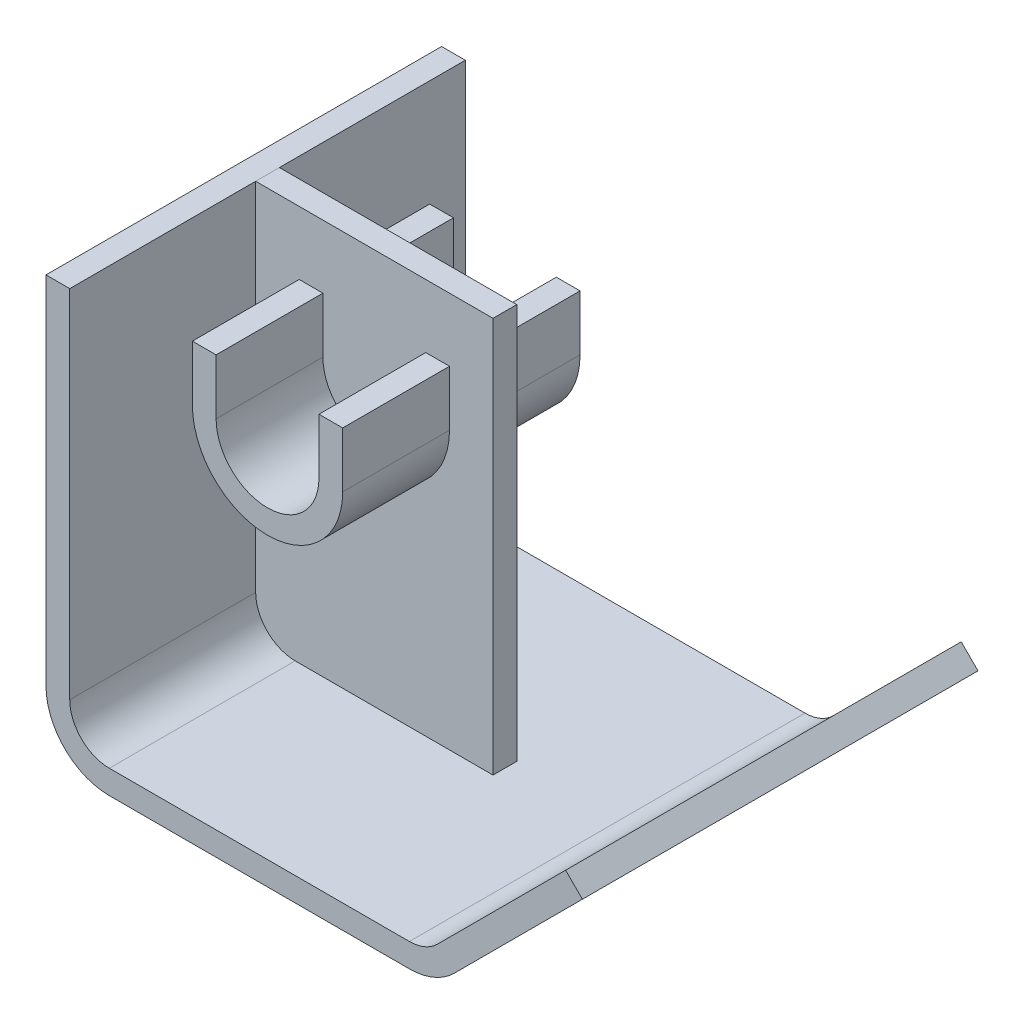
SolidWorks part; units mm, degrees
ref_plane "Front Plane" through (0, 0, 0) normal (0, 0, 1) x (1, 0, 0)
ref_plane "Top Plane" through (0, 0, 0) normal (0, 1, 0) x (1, 0, 0)
ref_plane "Right Plane" through (0, 0, 0) normal (1, 0, 0) x (0, 0, -1)
sketch "Sketch1" plane through (0, 0, 0) normal (0, 0, 1) x (1, 0, 0)
  line L0 (0, 0) -> (0, 50)
  line L1 (0, 0) -> (45, 0)
  line L2 (45, 0) -> (62.6777, 17.6777)
  dimension "D1" = 25
  dimension "D4" = 135
  dimension "D2" = 50
  dimension "D3" = 45
extrude "Extrude-Thin1" add sketch "Sketch1" along normal mid plane 50 thin
sketch "Sketch2" plane through (0, 0, 0) normal (1, 0, 0) x (0, 0, -1)
  line L0 (0, 50) -> (0, 0)
  line L1 (-25, 50) -> (25, 50) construction
extrude "Extrude-Thin2" add sketch "Sketch2" along normal blind 30 separate body thin
sketch "Sketch3" plane through (0, 0, 0) normal (0, 0, 1) x (1, 0, 0)
  line L0 (7, 42) -> (7, 35)
  line L1 (30, 50) -> (0, 50) construction
  line L2 (30, 50) -> (30, 0) construction
  line L3 (23, 35) -> (23, 42)
  arc A0 (7, 35) -> (23, 35) centre (15, 35) ccw
  dimension "D3" = 7
  dimension "D1" = 8
  dimension "D2" = 15
  dimension "D4" = 15
extrude "Extrude-Thin3" add sketch "Sketch3" along normal mid plane 30 separate body thin
